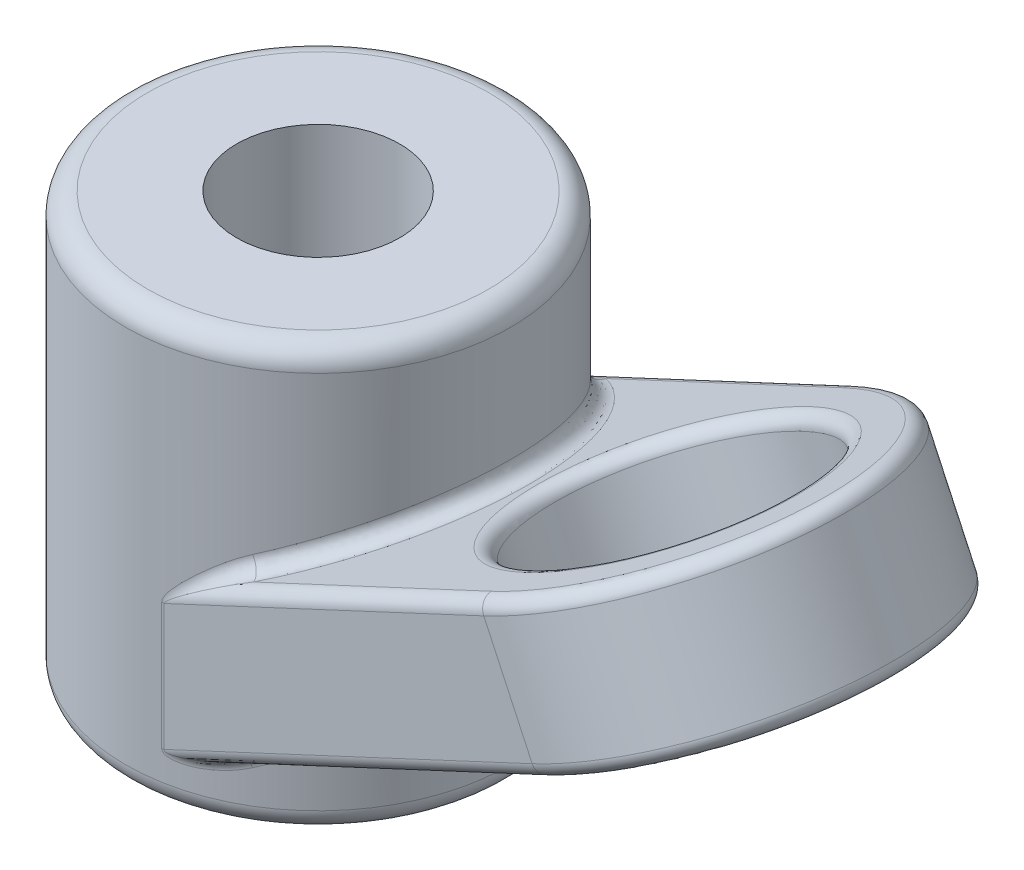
SolidWorks part; units mm, degrees
ref_plane "Plane1" through (0, 0, 0) normal (0, 0, 1) x (1, 0, 0)
ref_plane "Plane2" through (0, 0, 0) normal (0, 1, 0) x (1, 0, 0)
ref_plane "Plane3" through (0, 0, 0) normal (1, 0, 0) x (0, 0, -1)
sketch "Esquisse1" plane through (0, 0, 0) normal (0, 0, 1) x (1, 0, 0)
  line L0 (-38.7, 96) -> (-18.5, 96)
  line L1 (-43.7, 91) -> (-43.7, 5)
  line L2 (-33.7, 0) -> (-38.7, 0)
  line L3 (-18.5, 4) -> (-18.5, 96)
  line L4 (-33.7, 4) -> (-33.7, 0)
  line L5 (-33.7, 4) -> (-18.5, 4)
  line L6 (0, 101.2789) -> (0, -43.6652) construction
  arc A0 (-43.7, 91) -> (-38.7, 96) centre (-38.7, 91) cw
  arc A1 (-38.7, 0) -> (-43.7, 5) centre (-38.7, 5) cw
  point P14 (-43.7, 96)
  point P17 (-43.7, 0)
revolve "Base-Révolution" add sketch "Esquisse1" angle 360 about L6
ref_plane "Plan4" through (0, 22.3, 0) normal (0, 1, 0) x (-1, 0, 0)
sketch "Esquisse4" plane through (0, 22.3, 0) normal (0, 1, 0) x (-1, 0, 0)
  line L0 (0, 45.3889) -> (0, -47.2361) construction
ref_plane "Plan5" through (-8.5414, 18.3171, 0) normal (-0.4226, 0.9063, 0) x (-0.9063, -0.4226, 0)
sketch "Esquisse5" plane through (-8.5414, 18.3171, 0) normal (-0.4226, 0.9063, 0) x (-0.9063, -0.4226, 0)
  line L0 (-81.3926, 0) -> (137.5608, 0) construction
  line L1 (-9.4244, 45.3889) -> (-9.4244, -47.2361) construction
  line L2 (-104.4244, 43) -> (-57.6418, 43)
  line L3 (-104.4244, -43) -> (-57.6418, -43)
  line L4 (-57.6418, 43) -> (-57.6418, -43)
  circle A0 centre (-104.4244, 0) radius 25.6
  arc A1 (-104.4244, 43) -> (-104.4244, -43) centre (-104.4244, 0) ccw
extrude "Boss.-Extru.1" add sketch "Esquisse5" along normal mid plane 32
sketch "Esquisse7" plane through (52.2412, 24.3605, 0) normal (-0.9063, -0.4226, 0) x (0, 0, 1)
  line L3 (-23.3512, 36.2107) -> (-43, 36.2107)
  line L4 (-23.3512, 36.2107) -> (-43, 36.2107)
  line L5 (43, 36.2107) -> (23.3512, 36.2107)
  line L8 (-43, 36.2107) -> (-43, 4.2107)
  line L9 (43, 4.2107) -> (43, 36.2107)
  line L10 (43, 36.2107) -> (23.3512, 36.2107)
  line L11 (-43, 36.2107) -> (-43, 4.2107)
  line L12 (-43, 4.2107) -> (43, 4.2107)
  line L13 (-43, 4.2107) -> (43, 4.2107)
  line L14 (43, 4.2107) -> (43, 36.2107)
  ellipse E1 centre (0, 123.6132) end of major axis (0, 227.0162) minor radius 43.7 (-23.3512, 36.2107) -> (23.3512, 36.2107) ccw
  ellipse E2 centre (0, 123.6132) end of major axis (0, 227.0162) minor radius 43.7 (-23.3512, 36.2107) -> (23.3512, 36.2107) ccw
  dimension "D1" = 0
extrude "Boss.-Extru.2" add sketch "Esquisse7" along normal up to next
sketch "Esquisse9" plane through (-15.3033, 32.818, 0) normal (-0.4226, 0.9063, 0) x (-0.9063, -0.4226, 0)
  circle A0 centre (-104.4244, 0) radius 29.6
  dimension "D1" = 59.2
extrude "Enlèv. mat.-Extru.2" cut sketch "Esquisse9" against normal blind 23
fillet "Congé5" radius 3
equation "\"D4@Esquisse5\" = \"D1@Esquisse5\" - \"D3@Esquisse1\" / cos(\"D1@Plan5\"*0.01745293)"
